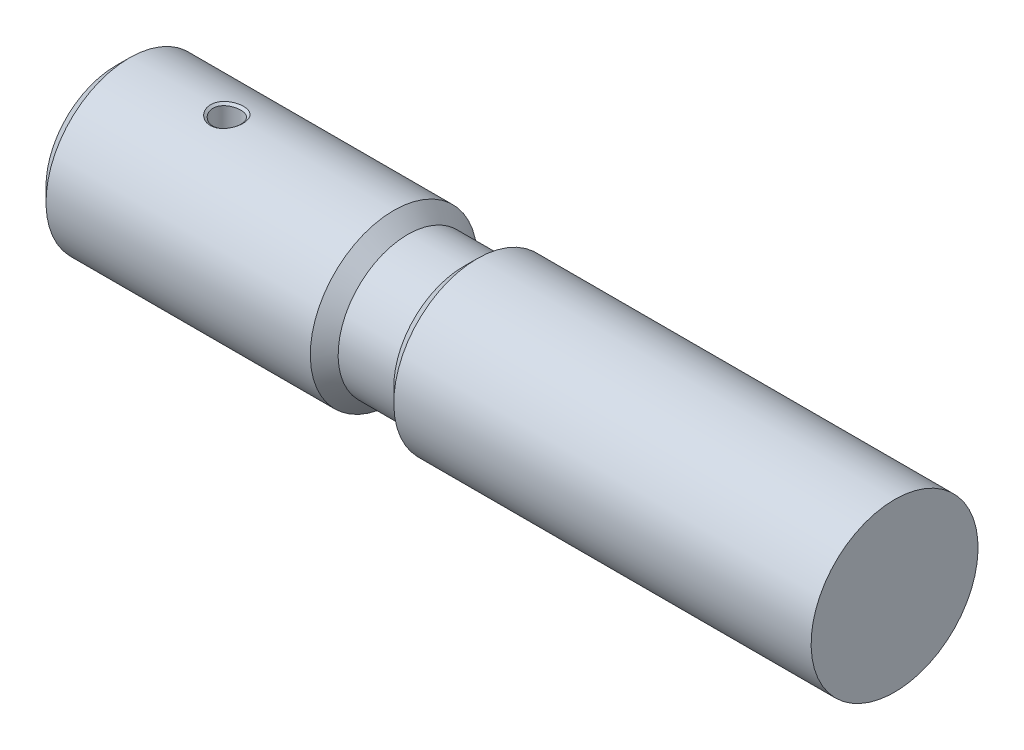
SolidWorks part; units mm, degrees
ref_plane "Plan de face" through (0, 0, 0) normal (0, 0, 1) x (1, 0, 0)
ref_plane "Plan de dessus" through (0, 0, 0) normal (0, 1, 0) x (1, 0, 0)
ref_plane "Plan de droite" through (0, 0, 0) normal (1, 0, 0) x (0, 0, -1)
sketch "Esquisse1" plane through (0, 0, 0) normal (0, 0, 1) x (1, 0, 0)
  line L0 (0, 0) -> (0, 2.5)
  line L1 (0, 2.5) -> (0.5, 3)
  line L2 (10, 3) -> (10.5, 2.5)
  line L3 (10.5, 2.5) -> (12.5, 2.5)
  line L4 (12.5, 2.5) -> (13, 3)
  line L5 (13, 3) -> (28, 3)
  line L6 (28, 3) -> (28, 0)
  line L7 (28, 0) -> (0, 0)
  line L8 (0.5, 3) -> (10, 3)
  dimension "D1" = 135
  dimension "D2" = 3
  dimension "D3" = 15
  dimension "D4" = 2.5
  dimension "D5" = 0.5
  dimension "D6" = 135
  dimension "D7" = 3
  dimension "D8" = 3
  dimension "D9" = 0.5
  dimension "D10" = 10
  dimension "D11" = 2
revolve "Révolution1" add sketch "Esquisse1" angle 360 about L7
sketch "Esquisse2" plane through (0, 0, 0) normal (-1, 0, 0) x (0, 0, 1)
  circle A0 centre (0, 0) radius 1.5
  dimension "D1" = 3
extrude "Enlèv. mat.-Extru.1" cut sketch "Esquisse2" against normal blind 8
sketch "Esquisse3" plane through (0, 0, 0) normal (0, 1, 0) x (1, 0, 0)
  line L0 (0, 2.5) -> (0, -2.5) construction
  circle A0 centre (4, 0) radius 0.5
  dimension "D1" = 1
  dimension "D2" = 4
extrude "Enlèv. mat.-Extru.2" cut sketch "Esquisse3" against normal mid plane 15
chamfer "Chanfrein1" distance 0.1 angle 45 2 edges at (4.4884, 2.9981, -0.1072) (4.1073, -2.96, -0.4884)
